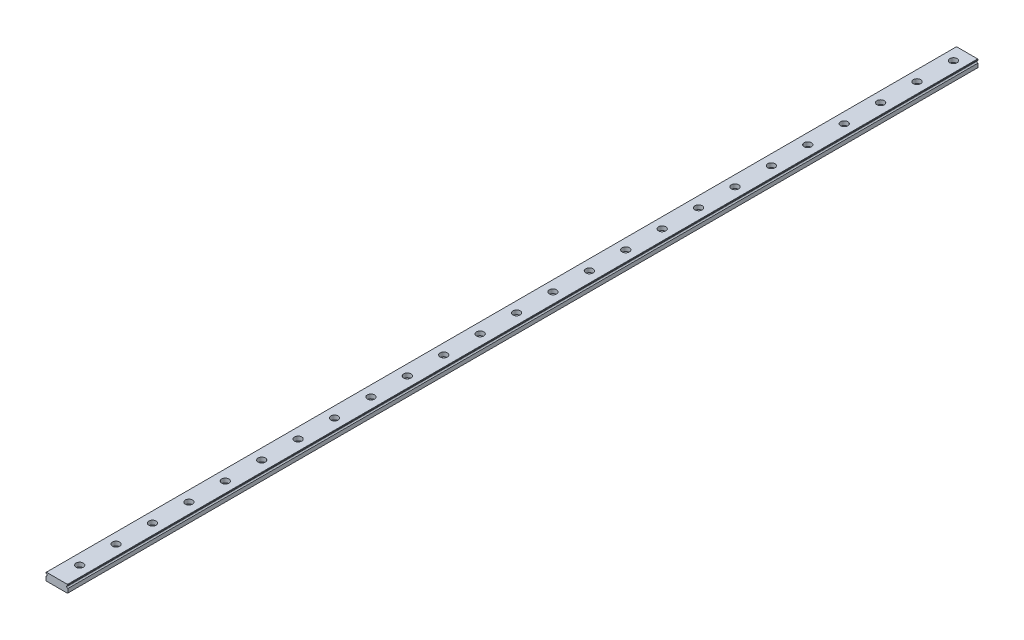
SolidWorks part; units mm, degrees
ref_plane "Front Plane" through (0, 0, 0) normal (0, 0, 1) x (1, 0, 0)
ref_plane "Top Plane" through (0, 0, 0) normal (0, 1, 0) x (1, 0, 0)
ref_plane "Right Plane" through (0, 0, 0) normal (1, 0, 0) x (0, 0, -1)
sketch "Sketch2" plane through (0, 0, 0) normal (0, 0, 1) x (1, 0, 0)
  line L0 (-12, 3.0091) -> (-12, 2.1591)
  line L1 (-12, -0.3409) -> (-12, -4.6909)
  line L2 (-12, -4.6909) -> (-11.6, -5.0909)
  line L3 (-11.6, -5.0909) -> (5.7, -5.0909)
  line L4 (6.3, -5.0909) -> (11.6, -5.0909)
  line L5 (11.6, -5.0909) -> (12, -4.6909)
  line L6 (12, -4.6909) -> (12, -0.3409)
  line L7 (12, 2.1591) -> (12, 3.0091)
  line L8 (12, 3.0091) -> (11.6, 3.4091)
  line L9 (11.6, 3.4091) -> (-11.6, 3.4091)
  line L10 (-11.6, 3.4091) -> (-12, 3.0091)
  line L11 (6.3, -5.0909) -> (5.7, -5.0909)
  arc A0 (-12, -0.3409) -> (-12, 2.1591) centre (-12, 0.9091) ccw
  arc A2 (10.75, 0.9091) -> (12, -0.3409) centre (12, 0.9091) ccw
  arc A3 (12, 2.1591) -> (10.75, 0.9091) centre (12, 0.9091) ccw
extrude "Boss-Extrude1" add sketch "Sketch2" along normal blind 1000 contours L3 L11 L4 L5 L6 A2 A3 L7 L8 L9 L10 L0 A0 L1 L2
sketch "Sketch3" plane through (0, 3.4091, 0) normal (0, 1, 0) x (1, 0, 0)
  line L0 (12, -1000) -> (12, 0) construction
  line L2 (11.6, 0) -> (-11.6, 0) construction
  point P0 (0, -15)
  dimension "D1" = 12
  dimension "D2" = 15
hole_wizard "CBORE for M16 Hex Head Bolt1" positions "Sketch3" profile "Sketch4" counterbore size "M16" standard "DIN"
sketch "Sketch4" plane through (0, 3.4091, 15) normal (1, 0, 0) x (0, 0, 1)
  line L0 (0, 0) -> (0, 8.5)
  line L1 (0, 8.5) -> (2.25, 8.5)
  line L3 (2.25, 8.5) -> (2.25, 4.5)
  line L4 (2.25, 4.5) -> (4, 4.5)
  line L5 (4, 4.5) -> (4, 0)
  line L7 (4, 0) -> (0, 0)
  line L11 (0, -6.35) -> (0, 107.95) construction
  dimension "Thru Hole Dia." = 4.5
  dimension "Thru Hole Depth" = 8.5
  dimension "C'Bore Dia." = 8
  dimension "C'Bore Depth" = 4.5
other "Fill Pattern1" parameters "D5"=0, "D6"=0, "D1"=40, "D2"=60, "D3"=0, "D9"=25, "D7"=25, "D8"=2
